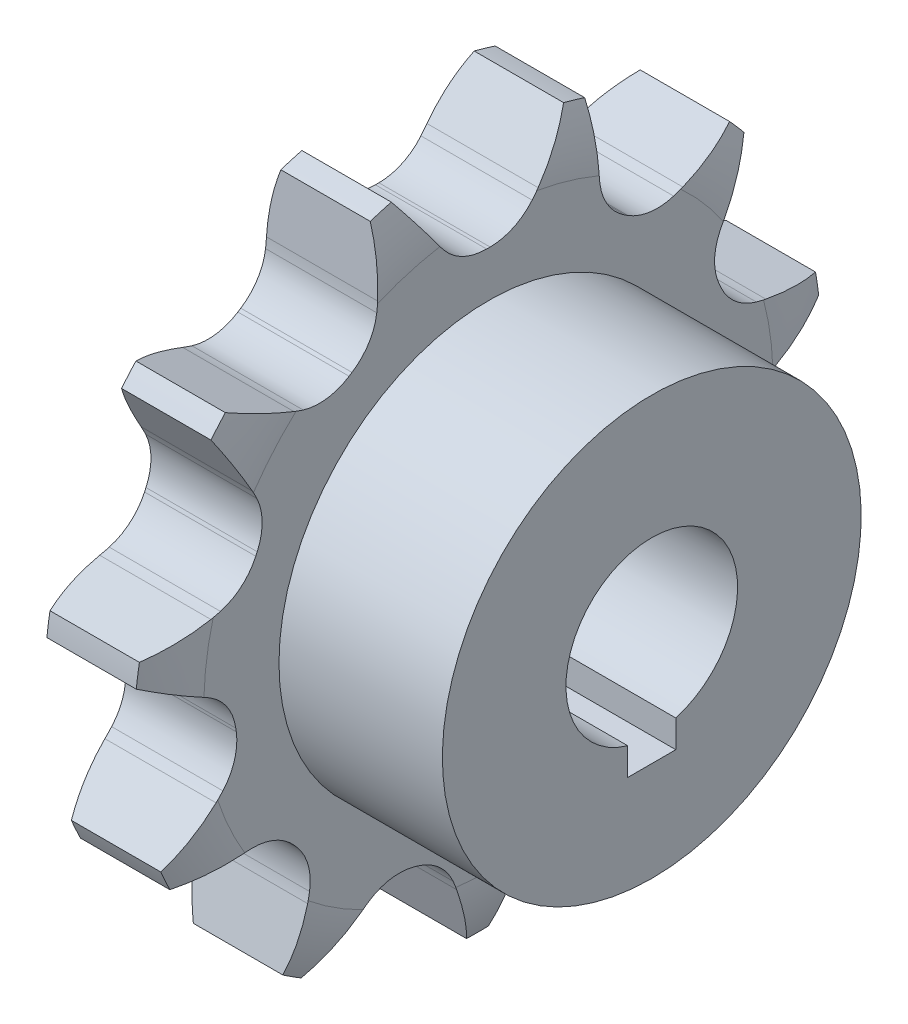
SolidWorks part; units mm, degrees
ref_plane "Front" through (0, 0, 0) normal (0, 0, 1) x (1, 0, 0)
ref_plane "Top" through (0, 0, 0) normal (0, 1, 0) x (1, 0, 0)
ref_plane "Right" through (0, 0, 0) normal (1, 0, 0) x (0, 0, -1)
imported_body "2116-11"
sketch "Esquisse1" plane through (40, 0, 0) normal (1, 0, 0) x (0, 0, -1)
  circle A0 centre (0, 0) radius 12.5
  dimension "D1" = 25
extrude "Enlèv. mat.-Extru.1" cut sketch "Esquisse1" against normal through all
sketch "Esquisse2" plane through (0, 0, 0) normal (0, 1, 0) x (1, 0, 0)
  line L0 (40, -30.5) -> (40, 30.5) construction
  line L1 (40, 3.5) -> (0, 3.5)
  line L2 (40, 3.5) -> (40, -3.5)
  line L3 (40, -3.5) -> (0, -3.5)
  line L4 (0, 3.5) -> (0, -3.5)
  line L5 (16.2, 0) -> (40, 0) construction
  dimension "D1" = 7
  dimension "D2" = 3.5
extrude "Enlèv. mat.-Extru.2" cut sketch "Esquisse2" against normal blind 16
